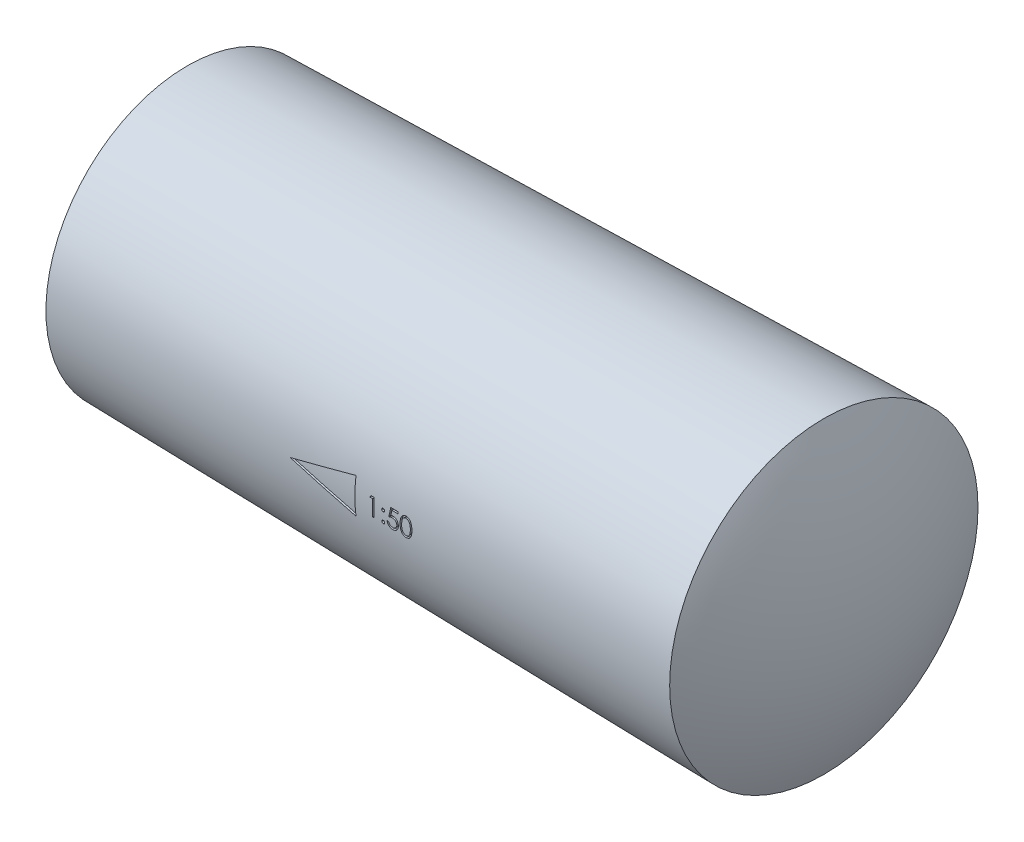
SolidWorks part; units mm, degrees
ref_plane "Front Plane" through (0, 0, 0) normal (0, 0, 1) x (1, 0, 0)
ref_plane "Top Plane" through (0, 0, 0) normal (0, 1, 0) x (1, 0, 0)
ref_plane "Right Plane" through (0, 0, 0) normal (1, 0, 0) x (0, 0, -1)
sketch "Sketch1" plane through (0, 0, 0) normal (1, 0, 0) x (0, 0, -1)
  circle A0 centre (0, 0) radius 8
  dimension "D1" = 16
extrude "Extrude1" add sketch "Sketch1" along normal mid plane 36
draft "Draft1" type of draft neutral plane draft angle 1.146 faces to draft 1 parameters "D1"=1.146
sketch "Sketch2" plane through (0, 0, 0) normal (0, 0, 1) x (1, 0, 0)
  line L0 (-18, 0) -> (-18, 8)
  line L1 (-18, 8) -> (-18, -8) construction
  line L2 (-18, 0) -> (-20, 0)
  line L3 (-20, 0) -> (-20, -8.36) construction
  line L4 (18, 0) -> (18, 8.72)
  line L5 (18, -8.72) -> (18, 8.72) construction
  line L6 (18, 0) -> (20, 0)
  line L7 (20, 0) -> (20, -8.36) construction
  line L8 (-18, -8) -> (18, -8.72) construction
  arc A0 (-20, 0) -> (-18, 8) centre (-3, 0) cw
  arc A1 (20, 0) -> (18, 8.72) centre (-0.0097, 0) ccw
  point P14 (0, -8.36)
revolve "Revolve1" add sketch "Sketch2" angle 360 about L2
sketch "Sketch5" plane through (0, 0, 0) normal (0, 0, 1) x (1, 0, 0)
  line L0 (0, 8.36) -> (0, -8.36) construction
  line L1 (18, 8.72) -> (-18, 8) construction
  line L2 (-18, -8) -> (18, -8.72) construction
ref_plane "Plane2" through (0, 0, 0) normal (-0.02, 0, 0.9998) x (0.9998, 0, 0.02)
sketch "Sketch6" plane through (0, 0, 0) normal (-0.02, 0, 0.9998) x (0.9998, 0, 0.02)
  line L0 (0, 0) -> (0, 1)
  line L1 (0, 8.36) -> (0, -8.36) construction
  line L2 (0, 1) -> (-3.7321, 0)
  line L3 (-3.7321, 0) -> (0, -1)
  line L4 (0, -1) -> (0, 0)
  line L5 (0, -0.5) -> (4, -0.5) construction
  text T0 "1:50" font "Century Gothic" height 1
  dimension "D1" = 2
  dimension "D2" = 30
  dimension "D3" = 4
wrap "Wrap2" sketch "Sketch6" wrap type deboss source sketch "Sketch6" thickness 0.1 parameters "D1"=0.1
equation "\"D2@Sketch2\" = \"D1@Sketch2\""
